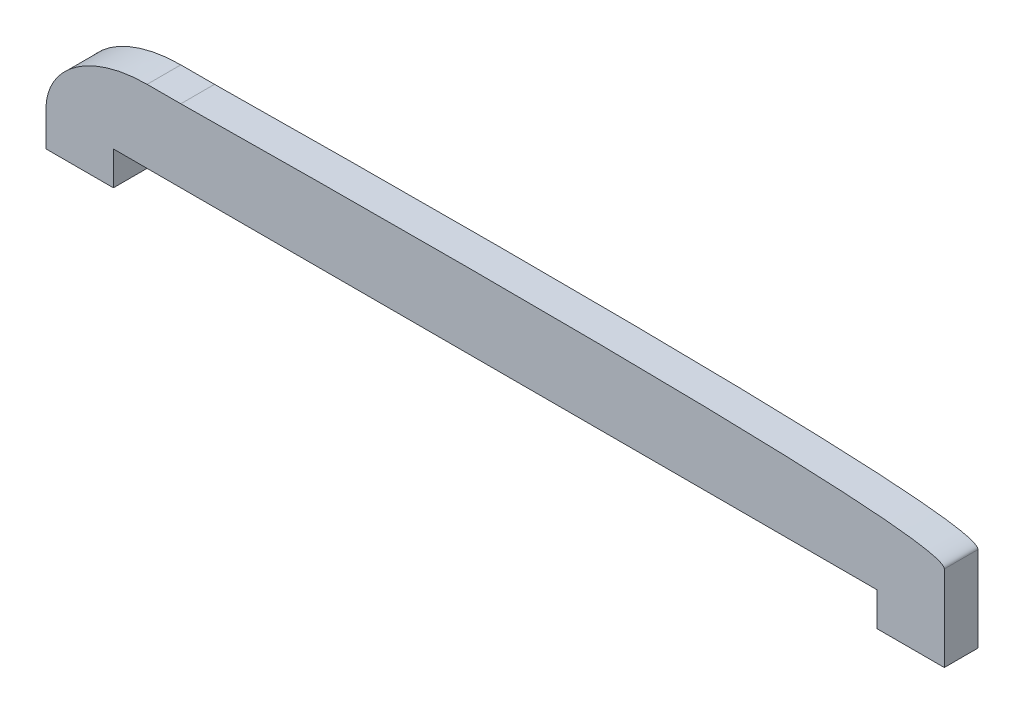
SolidWorks part; units mm, degrees
ref_plane "Front Plane" through (0, 0, 0) normal (0, 0, 1) x (1, 0, 0)
ref_plane "Top Plane" through (0, 0, 0) normal (0, 1, 0) x (1, 0, 0)
ref_plane "Right Plane" through (0, 0, 0) normal (1, 0, 0) x (0, 0, -1)
sketch "Sketch1" plane through (0, 0, 0) normal (0, 0, 1) x (1, 0, 0)
  line L0 (-3.175, 0) -> (-9.525, 0)
  line L1 (-9.525, 0) -> (-9.525, 3.175)
  line L2 (0, 10.033) -> (3.175, 10.033)
  line L3 (75.1025, 8.0464) -> (75.1025, 0)
  line L4 (75.1025, 0) -> (68.7525, 0)
  line L5 (68.7525, 0) -> (68.7525, 3.175)
  line L6 (68.7525, 3.175) -> (-3.175, 3.175)
  line L7 (-3.175, 3.175) -> (-3.175, 0)
  spline S0 degree 3 poles (-9.525, 3.175) (-9.5681, 6.9551) (-5.3607, 10.0266) (0, 10.033) knots 0 0 0 0 1 1 1 1
  spline S1 degree 3 poles (3.175, 10.033) (30.3685, 10.3557) (74.9511, 10.4584) (75.1025, 8.0464) knots 0 0 0 0 1 1 1 1
extrude "Boss-Extrude1" add sketch "Sketch1" against normal blind 3.175
